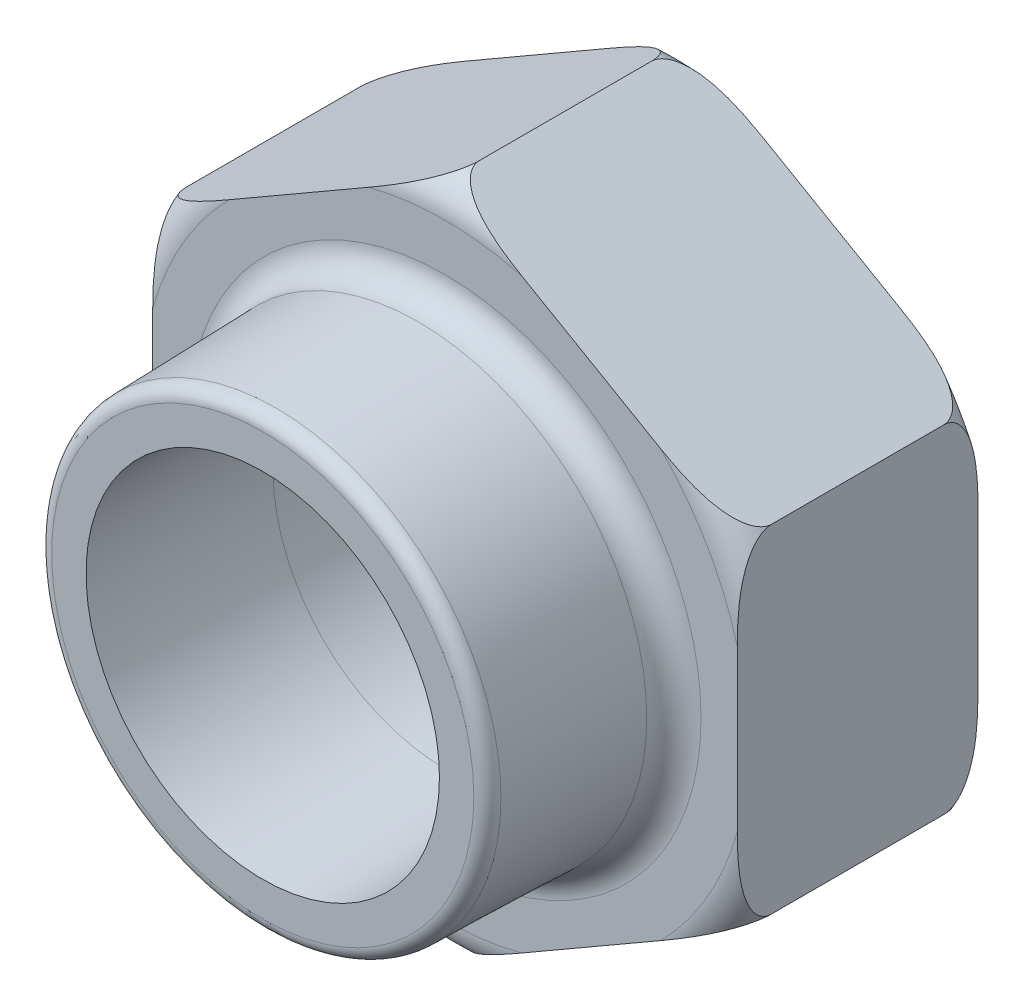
SolidWorks part; units mm, degrees
ref_plane "Face" through (0, 0, 0) normal (0, 0, 1) x (1, 0, 0)
ref_plane "Gauche" through (0, 0, 0) normal (0, 1, 0) x (1, 0, 0)
ref_plane "Dessus" through (0, 0, 0) normal (1, 0, 0) x (0, 0, -1)
sketch "Esquisse1" plane through (0, 0, 0) normal (0, 0, 1) x (1, 0, 0)
  line L0 (0, 0) -> (-49.3312, 0) construction
  line L1 (0, 0) -> (0, -43.0886) construction
  line L2 (-8.5, 4.9075) -> (-8.5, -4.9075)
  line L3 (8.5, 4.9075) -> (8.5, -4.9075)
  line L4 (-8.5, -4.9075) -> (0, -9.815)
  line L5 (8.5, -4.9075) -> (0, -9.815)
  line L7 (-8.5, 4.9075) -> (0, 9.815)
  line L9 (8.5, 4.9075) -> (0, 9.815)
  point P14 (-8.5, 0)
  point P17 (8.5, 0)
  dimension "D1" = 17
  dimension "A" = 17
  dimension "D3" = 17
  dimension "D4" = 30
extrude "Tete" add sketch "Esquisse1" along normal blind 7
sketch "Esquisse2" plane through (0, 0, 0) normal (1, 0, 0) x (0, 0, -1)
  line L0 (0, 0) -> (-68.4114, 0) construction
  line L1 (0, -4.9075) -> (0, -9.815) construction
  line L2 (-7, -9.815) -> (0, -9.815) construction
  line L3 (-1, -9.815) -> (-1, -19.815)
  line L4 (8.7711, -19.815) -> (-1, -19.815)
  line L5 (0, -8.815) -> (8.7711, -8.815)
  line L7 (8.7711, -8.815) -> (8.7711, -19.815)
  arc A0 (-1, -9.815) -> (0, -8.815) centre (-1, -8.815) ccw
  dimension "R" = 1
  dimension "D2" = 8.7711
  dimension "D3" = 10
revolve "Rayon de tete" cut sketch "Esquisse2" angle 360 about L0
ref_plane "Plan1" through (0, 0, 3.5) normal (0, 0, 1) x (1, 0, 0)
mirror "Symétrie1" about plane through (0, 0, 3.5) normal (0, 0, 1) of "Rayon de tete"
sketch "Esquisse3" plane through (0, 0, 0) normal (0, 0, -1) x (-1, 0, 0)
  circle A0 centre (0, 0) radius 5
  dimension "D" = 10
extrude "Enlèv. de mat.-Extru.1" cut sketch "Esquisse3" against normal through all
sketch "Esquisse4" plane through (0, 0, 7) normal (0, 0, 1) x (1, 0, 0)
  circle A0 centre (0, 0) radius 6.6667
  circle A1 centre (0, 0) radius 5 construction
  circle A2 centre (0, 0) radius 5
  dimension "Dn" = 13.3333
extrude "Boss.-Extru.1" add sketch "Esquisse4" along normal blind 5.3 draft 1.5
fillet "Congé1" radius 0.8 1 edges at (6.6667, 0, 7)
fillet "Congé3" radius 0.4 1 edges at (6.5279, 0, 12.3)
equation "\"D1@Esquisse1\" = \"A@Esquisse1\""
equation "\"D3@Esquisse1\" = \"A@Esquisse1\""
equation "\"D1@Plan1\" = \"B@Tete\"/2"
equation "\"Dn@Esquisse4\" = \"D@Esquisse3\"+ \"D@Esquisse3\"/3"
equation "\"Ra@Congé1\" = \"R@Esquisse2\"*0.8"
equation "\"D1@Congé3\" = \"Ra@Congé1\"/2"
